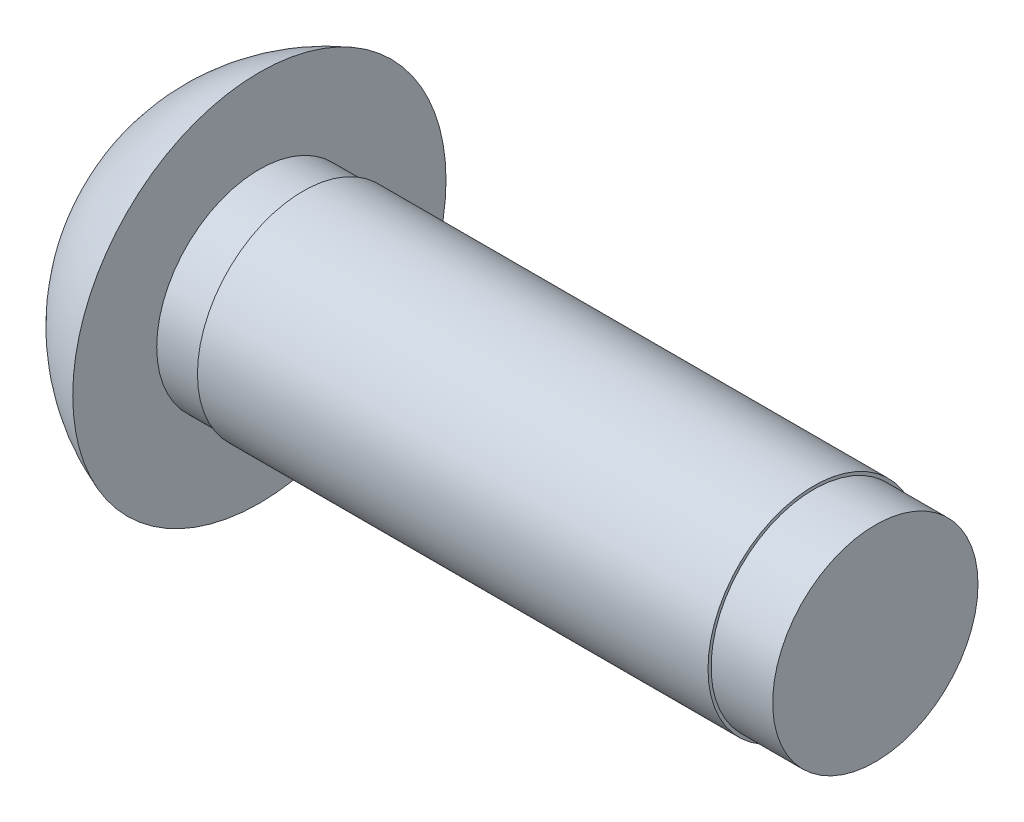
SolidWorks part; units mm, degrees
ref_plane "Front" through (0, 0, 0) normal (0, 0, 1) x (1, 0, 0)
ref_plane "Top" through (0, 0, 0) normal (0, 1, 0) x (1, 0, 0)
ref_plane "Right" through (0, 0, 0) normal (1, 0, 0) x (0, 0, -1)
sketch "Sketch1" plane through (0, 0, 0) normal (0, 0, 1) x (1, 0, 0)
  line L0 (-21.4237, 0) -> (6.6338, 0) construction
  line L1 (18.2, 0) -> (18.2, 2.5)
  line L2 (18.2, 2.5) -> (3.2, 2.5)
  line L3 (3.2, 2.5) -> (3.2, 4.545)
  line L4 (18.2, 0) -> (0, 0)
  arc A0 (3.2, 4.545) -> (0, 0) centre (4.8277, 0) ccw
  dimension "d" = 5
  dimension "K" = 3.2
  dimension "l" = 15
  dimension "dk" = 9.09
revolve "BaseHead" add sketch "Sketch1" angle 360 about L0
sketch "Sketch2" plane through (18.2, 0.8051, 1.1722) normal (1, 0, 0) x (0, 0, -1)
  circle A0 centre (1.1722, -0.8051) radius 2.575
  circle A1 centre (1.1722, -0.8051) radius 2.5 construction
  dimension "d1" = 5.15
extrude "BaseBody" add sketch "Sketch2" against normal offset from surface (13.9333 mm away) 1.0667
sketch "Sketch3" plane through (0, 0, 0) normal (0, 0, 1) x (1, 0, 0)
  line L0 (0.8134, 0) -> (-2.3781, 0) construction
  line L2 (18.2, 2.5) -> (16.7, 2.5)
  line L4 (16.7, 2.5) -> (16.7, 8.5)
  line L5 (16.7, 8.5) -> (18.2, 8.5)
  line L6 (18.2, 8.5) -> (18.2, 2.5)
  line L9 (18.2, -2.575) -> (18.2, 2.575) construction
  line L11 (4.2667, 2.5) -> (3.2, 2.5) construction
  dimension "l1" = 1.5
  dimension "D2" = 6
revolve "Cut-Revolve1" cut sketch "Sketch3" angle 360 about L0
equation "\"D1@BaseBody\" = \"K@Sketch1\" / 3"
